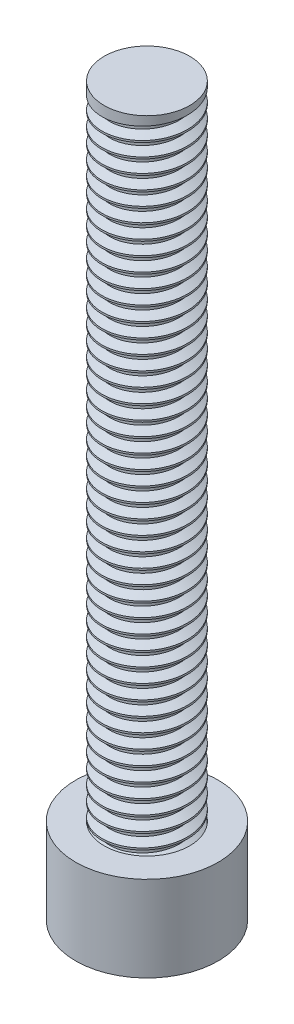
SolidWorks part; units mm, degrees
ref_plane "Front Plane" through (0, 0, 0) normal (0, 0, 1) x (1, 0, 0)
ref_plane "Top Plane" through (0, 0, 0) normal (0, 1, 0) x (1, 0, 0)
ref_plane "Right Plane" through (0, 0, 0) normal (1, 0, 0) x (0, 0, -1)
sketch "Sketch1" plane through (0, 0, 0) normal (0, 1, 0) x (1, 0, 0)
  circle A0 centre (0, 0) radius 5
  dimension "D1" = 10
extrude "Boss-Extrude1" add sketch "Sketch1" along normal blind 6
sketch "Sketch2" plane through (0, 6, 0) normal (0, 1, 0) x (1, 0, 0)
  circle A0 centre (0, 0) radius 3
extrude "Boss-Extrude2" add sketch "Sketch2" along normal blind 45
sketch "Sketch3" plane through (0, 0, 0) normal (0, -1, 0) x (1, 0, 0)
  line L1 (-1.4445, 2.5019) -> (-2.8889, 0)
  line L2 (-2.8889, 0) -> (-1.4445, -2.5019)
  line L3 (-1.4445, -2.5019) -> (1.4445, -2.5019)
  line L4 (1.4445, -2.5019) -> (2.8889, 0)
  line L5 (2.8889, 0) -> (1.4445, 2.5019)
  line L6 (1.4445, 2.5019) -> (-1.4445, 2.5019)
  circle A0 centre (0, 0) radius 2.5019 construction
  dimension "D1" = 5.0038
extrude "Cut-Extrude1" cut sketch "Sketch3" against normal blind 5
thread "Thread1" pitch 1 start angle 0, offset 0, length 0, pitch 1, diameter 6
ref_plane "Plane1" through (-3, 51, 0) normal (0, 0, 1) x (-1, 0, 0)
sketch "Thread Profile1" plane through (-3, 51, 0) normal (0, 0, 1) x (-1, 0, 0)
  line L0 (0, 0) -> (0, 1) construction
  line L11 (0, 0) -> (0, 0.875)
  line L12 (0, 0.875) -> (-0.5413, 0.5625)
  line L13 (-0.5413, 0.5625) -> (-0.5413, 0.3125)
  line L15 (-0.5413, 0.3125) -> (0, 0)
  line L17 (-0.5413, 0.4375) -> (0, 0.4375) construction
  point P2 (0, 0)
  dimension "Pitch" = 1
  dimension "Profile_Angle" = 60
  dimension "Profile_Land" = 0.25
  dimension "Profile_Height" = 0.5413
